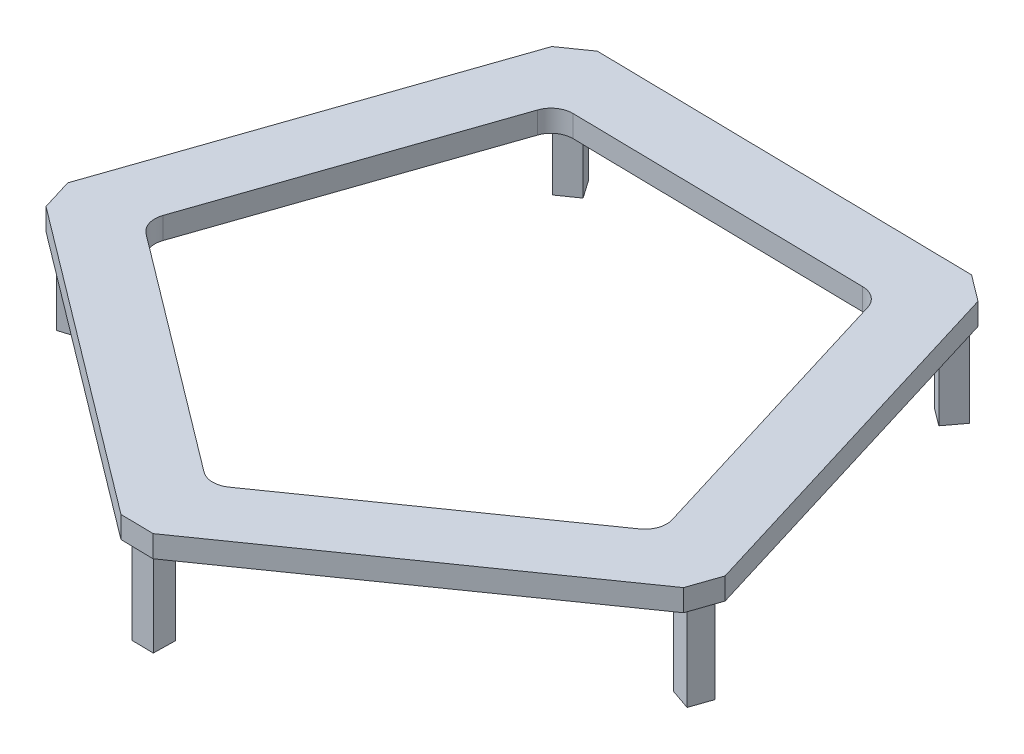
SolidWorks part; units mm, degrees
ref_plane "Front Plane" through (0, 0, 0) normal (0, 0, 1) x (1, 0, 0)
ref_plane "Top Plane" through (0, 0, 0) normal (0, 1, 0) x (1, 0, 0)
ref_plane "Right Plane" through (0, 0, 0) normal (1, 0, 0) x (0, 0, -1)
sketch "Sketch2" plane through (0, 0, 0) normal (0, 1, 0) x (1, 0, 0)
  line L0 (2.9997, -101.0327) -> (-6.5239, -100.8665)
  line L1 (-6.5239, -100.8665) -> (-95.1609, -34.0737)
  line L2 (-95.1609, -34.0737) -> (-97.9457, -24.9649)
  line L3 (-97.9457, -24.9649) -> (-61.8124, 79.974)
  line L4 (-61.8124, 79.974) -> (-54.0099, 85.4373)
  line L5 (-54.0099, 85.4373) -> (56.9588, 83.5004)
  line L6 (56.9588, 83.5004) -> (64.5658, 77.7681)
  line L7 (64.5658, 77.7681) -> (97.0148, -28.368)
  line L8 (97.0148, -28.368) -> (93.9138, -37.374)
  line L9 (93.9138, -37.374) -> (2.9997, -101.0327)
  line L10 (3.1659, -91.5092) -> (-6.3576, -91.343)
  line L16 (-6.3576, -91.343) -> (-86.0521, -31.2889)
  line L17 (-86.0521, -31.2889) -> (-88.8369, -22.1801)
  line L18 (-88.8369, -22.1801) -> (-56.349, 72.1716)
  line L19 (-56.349, 72.1716) -> (-48.5466, 77.6349)
  line L20 (-48.5466, 77.6349) -> (51.2265, 75.8934)
  line L21 (51.2265, 75.8934) -> (58.8335, 70.1611)
  line L22 (58.8335, 70.1611) -> (88.0087, -25.2669)
  line L23 (88.0087, -25.2669) -> (84.9077, -34.273)
  line L24 (84.9077, -34.273) -> (3.1659, -91.5092)
extrude "Boss-Extrude1" add sketch "Sketch2" along normal blind 6.35
sketch "Sketch3" plane through (0, 0, 0) normal (0, -1, 0) x (1, 0, 0)
  line L0 (-4.9089, 99.307) -> (1.4401, 99.4178)
  line L1 (-4.9089, 99.307) -> (-4.7981, 92.9579)
  line L2 (1.4401, 99.4178) -> (1.551, 93.0687)
  line L3 (-4.7981, 92.9579) -> (1.551, 93.0687)
  line L4 (-95.9635, 26.0189) -> (-94.1069, 32.0914)
  line L5 (-95.9635, 26.0189) -> (-89.8909, 24.1623)
  line L6 (-94.1069, 32.0914) -> (-88.0344, 30.2349)
  line L7 (-89.8909, 24.1623) -> (-88.0344, 30.2349)
  line L8 (-54.3998, -83.2264) -> (-50.7576, -78.0248)
  line L9 (-54.3998, -83.2264) -> (-59.6014, -79.5842)
  line L10 (-50.7576, -78.0248) -> (-55.9592, -74.3826)
  line L11 (-59.6014, -79.5842) -> (-55.9592, -74.3826)
  line L12 (57.2712, -81.2772) -> (53.4497, -76.2058)
  line L13 (57.2712, -81.2772) -> (62.3425, -77.4556)
  line L14 (53.4497, -76.2058) -> (58.521, -72.3843)
  line L15 (62.3425, -77.4556) -> (58.521, -72.3843)
  line L16 (88.9929, 27.2848) -> (94.997, 29.3521)
  line L17 (88.9929, 27.2848) -> (86.9256, 33.2888)
  line L18 (94.997, 29.3521) -> (92.9296, 35.3562)
  line L19 (86.9256, 33.2888) -> (92.9296, 35.3562)
  line L20 (62.3425, -77.4556) -> (57.2712, -81.2772) construction
  line L21 (92.9296, 35.3562) -> (94.997, 29.3521) construction
  line L22 (1.4401, 99.4178) -> (1.551, 93.0687) construction
extrude "Boss-Extrude2" add sketch "Sketch3" along normal blind 25.4
sketch "Sketch4" plane through (0, 6.35, 0) normal (0, 1, 0) x (1, 0, 0)
  line L24 (-1.4115, -80.8657) -> (76.4717, -26.3313)
  line L25 (76.4717, -26.3313) -> (48.6736, 64.5921)
  line L26 (48.6736, 64.5921) -> (-46.3898, 66.2514)
  line L27 (-46.3898, 66.2514) -> (-77.3441, -23.6465)
  line L28 (-77.3441, -23.6465) -> (-1.4115, -80.8657)
  line L29 (-1.4115, -80.8657) -> (76.4717, -26.3313)
  line L30 (76.4717, -26.3313) -> (48.6736, 64.5921)
  line L31 (48.6736, 64.5921) -> (-46.3898, 66.2514)
  line L32 (-46.3898, 66.2514) -> (-77.3441, -23.6465)
  line L33 (-77.3441, -23.6465) -> (-1.4115, -80.8657)
  line L99 (-88.8369, -22.1801) -> (-86.0521, -31.2889)
  line L100 (-86.0521, -31.2889) -> (-6.3576, -91.343)
  line L101 (-6.3576, -91.343) -> (3.1659, -91.5092)
  line L102 (3.1659, -91.5092) -> (84.9077, -34.273)
  line L103 (84.9077, -34.273) -> (88.0087, -25.2669)
  line L104 (88.0087, -25.2669) -> (58.8335, 70.1611)
  line L105 (58.8335, 70.1611) -> (51.2265, 75.8934)
  line L106 (51.2265, 75.8934) -> (-48.5466, 77.6349)
  line L107 (-48.5466, 77.6349) -> (-56.349, 72.1716)
  line L108 (-56.349, 72.1716) -> (-88.8369, -22.1801)
  line L109 (-88.8369, -22.1801) -> (-86.0521, -31.2889)
  line L110 (-86.0521, -31.2889) -> (-6.3576, -91.343)
  line L111 (-6.3576, -91.343) -> (3.1659, -91.5092)
  line L112 (3.1659, -91.5092) -> (84.9077, -34.273)
  line L113 (84.9077, -34.273) -> (88.0087, -25.2669)
  line L114 (88.0087, -25.2669) -> (58.8335, 70.1611)
  line L115 (58.8335, 70.1611) -> (51.2265, 75.8934)
  line L116 (51.2265, 75.8934) -> (-48.5466, 77.6349)
  line L117 (-48.5466, 77.6349) -> (-56.349, 72.1716)
  line L118 (-56.349, 72.1716) -> (-88.8369, -22.1801)
  dimension "D1" = 19.05
  dimension "D2" = 0
extrude "Boss-Extrude3" add sketch "Sketch4" against normal up to surface (6.35 mm away)
fillet "Fillet1" radius 6.35 5 edges at (48.6736, 3.175, -64.5921) (-1.4115, 3.175, 80.8657) (76.4717, 3.175, 26.3313) (-77.3441, 3.175, 23.6465) (-46.3898, 3.175, -66.2514)
